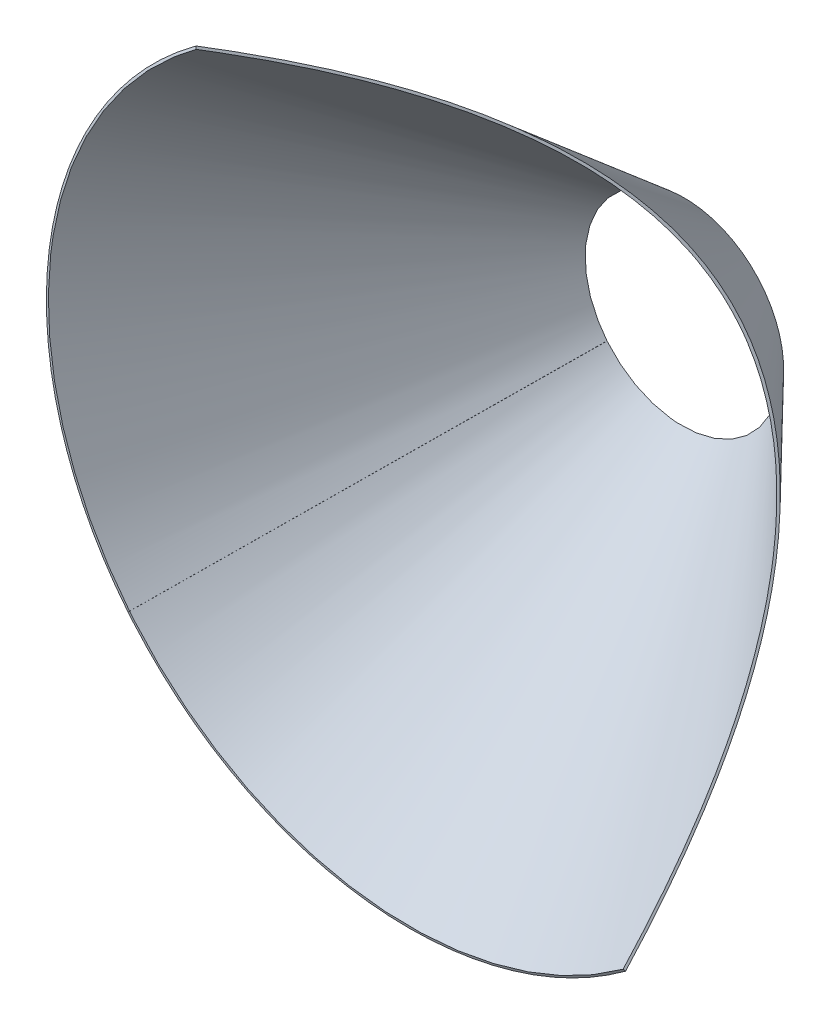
SolidWorks part; units mm, degrees
other "<konus_2>-<Schnitt-Linear austragen3>" parameters "Dicke"=4
ref_plane "Ebene vorne" through (0, 0, 0) normal (0, 0, 1) x (1, 0, 0)
ref_plane "Ebene oben" through (0, 0, 0) normal (0, 1, 0) x (1, 0, 0)
ref_plane "Ebene rechts" through (0, 0, 0) normal (1, 0, 0) x (0, 0, -1)
sketch "Skizze1" plane through (0, 0, 0) normal (0, 0, 1) x (1, 0, 0)
  line L0 (0, 0) -> (-296.65, -241.79) construction
  line L2 (0, 0) -> (-465.0833, -379.0746) construction
  arc A0 (-465.0833, -379.0746) -> (-465.1464, -378.9971) centre (0, 0) ccw
  dimension "D1" = 1200
  dimension "D2" = 0.1
  dimension "D3" = 241.79
  dimension "D4" = 296.65
ref_plane "Ebene1" through (0, 0, -750) normal (0, 0, 1) x (1, 0, 0)
sketch "Skizze2" plane through (0, 0, -750) normal (0, 0, 1) x (1, 0, 0)
  line L0 (-296.65, -241.79) -> (-422.2225, -344.1401) construction
  line L1 (-296.65, -241.79) -> (-134.65, -241.79) construction
  line L2 (0, 0) -> (-296.65, -241.79) construction
  arc A0 (-422.2225, -344.1401) -> (-422.3225, -344.0173) centre (-296.65, -241.79) ccw
  dimension "D1" = 324
  dimension "D2" = 296.65
  dimension "D3" = 241.79
  dimension "D4" = 0.1
sheet metal parameters "Blech1" thickness 4 parameters "D1"=0.7366
lofted bend "Ausgeformte Biegungen1" thickness 4 parameters "D1"=0
other "Freiform-Biegung1" parameters "D1"=1000, "D4"=57.296, "D5"=1
ref_plane "Ebene vorne-konus_2" through (0, 0, 0) normal (0, 0, 1) x (1, 0, 0)
ref_plane "Ebene oben-konus_2" through (0, 0, 0) normal (0, 1, 0) x (1, 0, 0)
ref_plane "Ebene rechts-konus_2" through (0, 0, 0) normal (1, 0, 0) x (0, 0, -1)
ref_plane "Ebene1-konus_2" through (0, 0, -750) normal (0, 0, 1) x (1, 0, 0)
inserted part "konus_2"
move or copy body "Körper-Verschieben/Kopieren2" placed by mates yes
sketch3d "3D-Skizze1"
  line L1 (-384.9885, 492.2705, 0) -> (-346.0553, 474.6143, -28.0683) construction
  line L2 (309.0866, -450.8004, 0) -> (354.2179, -483.1431, -9.8352) construction
  point P3 (0, -1346.4627, 176.3084)
  point P15 (29.2045, 0.755, -532.1074)
ref_plane "Ebene6" through (-0.0681, -0.0498, -0.0038) normal (0.806, 0.5902, 0.0452) x (0.0365, 0.0267, -0.999)
sketch "Skizze4" plane through (-0.0681, -0.0498, -0.0038) normal (0.806, 0.5902, 0.0452) x (0.0365, 0.0267, -0.999)
  line L1 (-470.7075, -1347.3178) -> (1241.1197, -1347.3178)
  line L2 (-470.7075, -1347.3178) -> (-470.7075, 2117.6405)
  line L3 (-470.7075, 2117.6405) -> (1241.1197, 2117.6405)
  line L4 (1241.1197, -1347.3178) -> (1241.1197, 2117.6405)
extrude "Schnitt-Linear austragen3" cut sketch "Skizze4" along normal through all
flat pattern "Abwicklung1"
sketch "Biegung-Linien1" plane through (-462.6968, -376.8684, -43.9964) normal (0.7733, 0.6298, 0.0735) x (0.057, 0.0464, -0.9973)
  line L0 (-44.1158, -0.104) -> (707.9198, -0.0258) construction
  line L1 (-39.736, 252.6496) -> (709.4194, 74.4985) construction
  line L2 (-22.1406, 504.3069) -> (714.1752, 137.4931) construction
  line L3 (20.5344, 752.322) -> (726.052, 204.9247) construction
  line L4 (151.9463, 936.4219) -> (748.7142, 269.374) construction
  line L5 (479.3367, 814.5134) -> (784.9947, 327.1727) construction
  line L6 (675.9412, 756.7229) -> (835.0618, 373.2872) construction
  line L7 (818.9964, 737.0007) -> (896.5044, 403.0618) construction
  line L8 (943.0063, 746.7518) -> (964.0726, 412.9394) construction
  line L9 (1071.0242, 787.444) -> (1031.467, 402) construction
  line L10 (1230.3374, 871.4575) -> (1092.6408, 372.1512) construction
  line L11 (1474.808, 1032.2172) -> (1143.9548, 327.1639) construction
  line L12 (1702.8779, 998.7818) -> (1184.1325, 271.9093) construction
  line L13 (1814.9128, 773.4355) -> (1214.8403, 210.7115) construction
  line L14 (1903.9733, 537.4076) -> (1237.4639, 151.7198) construction
  line L15 (1980.6919, 296.5379) -> (1260.2761, 80.7635) construction
sketch3d "Rahmen1" [suppressed]
  line L0 (1665.8155, 143.0329, 0) -> (-366.8952, -82.3242, 0) construction
  line L1 (1553.1277, 1159.4715, 0) -> (-479.583, 934.1144, 0) construction
  line L2 (1665.8155, 143.0329, 0) -> (1553.1277, 1159.4715, 0) construction
  line L3 (-366.8952, -82.3242, 0) -> (-479.583, 934.1144, 0) construction
other "Abwickeln-<Freiform-Biegung1>1"
